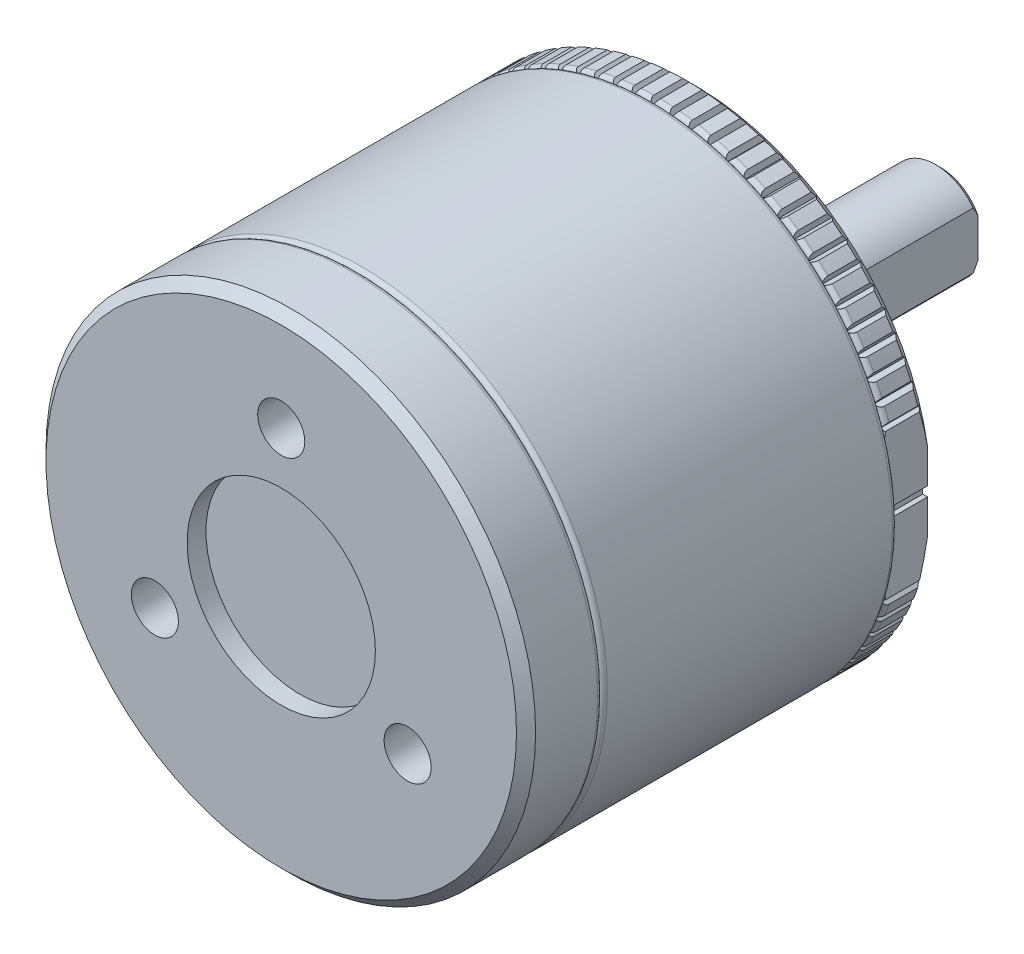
SolidWorks part; units mm, degrees
ref_plane "Front Plane" through (0, 0, 0) normal (0, 0, 1) x (1, 0, 0)
ref_plane "Top Plane" through (0, 0, 0) normal (0, 1, 0) x (1, 0, 0)
ref_plane "Right Plane" through (0, 0, 0) normal (1, 0, 0) x (0, 0, -1)
sketch "Sketch1" plane through (0, 0, 0) normal (1, 0, 0) x (0, 0, -1)
  line L0 (0, 5) -> (0, 12.492)
  line L1 (55, 0) -> (-55, 0) construction
  line L2 (19.964, 13) -> (21.492, 13)
  line L3 (22, 12.492) -> (22, 5)
  line L4 (21, 2.5) -> (34.746, 2.5)
  line L5 (35, 2.246) -> (35, 0)
  line L6 (35, 0) -> (1, 0)
  line L7 (1, 0) -> (1, 5)
  line L8 (1, 5) -> (0, 5)
  line L9 (-61.5609, 0) -> (59.5214, 0) construction
  line L10 (0, 55) -> (0, -55) construction
  line L11 (0, 12.492) -> (0.508, 13)
  line L12 (21.492, 13) -> (22, 12.492)
  line L13 (34.746, 2.5) -> (35, 2.246)
  line L14 (22, 5) -> (21, 5)
  line L15 (21, 5) -> (21, 2.5)
  line L16 (19.71, 12.746) -> (19.71, 12.5)
  line L17 (0.508, 13) -> (3.806, 13)
  line L18 (19.7099, 12.746) -> (19.7099, 12.5)
  line L19 (19.7099, 12.5) -> (19.71, 12.5)
  line L20 (4.06, 12.746) -> (4.06, 12.5)
  line L21 (4.061, 12.746) -> (4.061, 12.5)
  line L22 (4.315, 13) -> (19.4559, 13)
  line L23 (4.06, 12.5) -> (4.061, 12.5)
  arc A0 (19.71, 12.746) -> (19.964, 13) centre (19.964, 12.746) cw
  arc A1 (19.4559, 13) -> (19.7099, 12.746) centre (19.4559, 12.746) cw
  arc A2 (4.061, 12.746) -> (4.315, 13) centre (4.315, 12.746) cw
  arc A3 (4.06, 12.746) -> (3.806, 13) centre (3.806, 12.746) ccw
  point P1 (0, 13)
  point P5 (22, 13)
  point P7 (35, 2.5)
  point P37 (4.061, 13)
  dimension "D8" = 0.254
  dimension "D9" = 0.254
  dimension "D15" = 0.254
  dimension "D1" = 22
  dimension "D2" = 35
  dimension "D3" = 1
  dimension "D4" = 1
  dimension "D5" = 10
  dimension "D6" = 26
  dimension "D7" = 5
  dimension "D13" = 0.0001
  dimension "D14" = 2.29
  dimension "D16" = 0.001
  dimension "D17" = 4.06
  dimension "D18" = 0.5
revolve "Revolve1" add sketch "Sketch1" angle 360 about L9
hole_wizard "M3x0.5 Tapped Hole1" positions "Sketch3" profile "Sketch2" tap size "M3x0.5" standard "Ansi Metric"
sketch "Sketch3" plane through (0, 0, -22) normal (0, 0, -1) x (-1, 0, 0)
  line L0 (0, 0) -> (0, 7.75) construction
  line L3 (0, 0) -> (6.7117, -3.875) construction
  line L6 (0, 0) -> (-6.7117, -3.875) construction
  circle A0 centre (0, 0) radius 7.75
  point P0 (0, 7.75)
  point P1 (6.7117, -3.875)
  point P3 (-6.7117, -3.875)
  dimension "D1" = 15.5
  dimension "D2" = 120
  dimension "D3" = 120
sketch "Sketch2" plane through (0, 7.75, -22) normal (1, 0, 0) x (0, 1, 0)
  line L0 (0, 0) -> (0, 6.7511)
  line L1 (0, 6.7511) -> (1.25, 6)
  line L2 (1.25, 6) -> (1.25, 0)
  line L5 (1.25, 0) -> (0, 0)
  line L10 (0, 6.7511) -> (-1.25, 6) construction
  line L11 (0, -6.35) -> (0, 107.95) construction
  dimension "Tap Drill Dia." = 2.5
  dimension "Tap Drill Depth" = 6
  dimension "Drill Angle" = 118
ref_plane "Plane1" through (0, 0, -11) normal (0, 0, -1) x (-1, 0, 0)
mirror "Mirror1" about plane through (0, 0, -11) normal (0, 0, -1) of "M3x0.5 Tapped Hole1"
sketch "Sketch4" plane through (0, 0, -22) normal (0, 0, -1) x (-1, 0, 0)
  line L0 (-0.508, 13.5799) -> (0.508, 13.5799)
  line L1 (0, 12.7) -> (0.508, 13.5799)
  line L3 (-0.508, 13.5799) -> (0, 12.7)
  line L4 (0, 0) -> (0, 13) construction
  line L6 (0.4399, 13.462) -> (-0.4399, 13.462)
  circle A0 centre (0, 0) radius 13 construction
  dimension "D1" = 1.016
  dimension "D3" = 12.7
extrude "Cut-Extrude1" cut sketch "Sketch4" against normal blind 2.29
pattern_circular "CirPattern1" count 80 over 360 about axis through (0, 0, 0) along (0, 0, 1) of "Cut-Extrude1"
sketch "Sketch5" plane through (0, 0, -22) normal (0, 0, -1) x (-1, 0, 0)
  line L0 (-12.319, 0.254) -> (-12.065, 0.254)
  line L1 (-17.319, 5) -> (-12.319, 5)
  line L2 (-17.319, 5) -> (-17.319, -5)
  line L3 (-17.319, -5) -> (-12.319, -5)
  line L4 (-12.319, 5) -> (-12.319, 0.254)
  line L5 (-12.065, 0.254) -> (-12.065, -0.254)
  line L6 (-12.065, -0.254) -> (-12.319, -0.254)
  line L7 (-17.319, 0) -> (-12.319, 0) construction
  line L8 (-12.319, -0.254) -> (-12.319, -5)
  dimension "D1" = 12.319
  dimension "D2" = 0.508
  dimension "D3" = 0.254
  dimension "D4" = 10
  dimension "D5" = 5
  dimension "D6" = 5
extrude "Cut-Extrude2" cut sketch "Sketch5" against normal blind 2.29
sketch "Sketch6" plane through (0, 0, -35) normal (0, 0, -1) x (-1, 0, 0)
  line L0 (0, 0) -> (-2.246, 0) construction
  line L1 (-3, 2.5) -> (-2, 2.5)
  line L2 (-3, 2.5) -> (-3, -2.5)
  line L3 (-3, -2.5) -> (-2, -2.5)
  line L4 (-2, 2.5) -> (-2, -2.5)
  circle A0 centre (0, 0) radius 2.246 construction
  circle A7 centre (0, 0) radius 2.5 construction
  dimension "D1" = 4.5
  dimension "D2" = 5
  dimension "D3" = 1
extrude "Cut-Extrude3" cut sketch "Sketch6" against normal up to surface (13 mm away)
